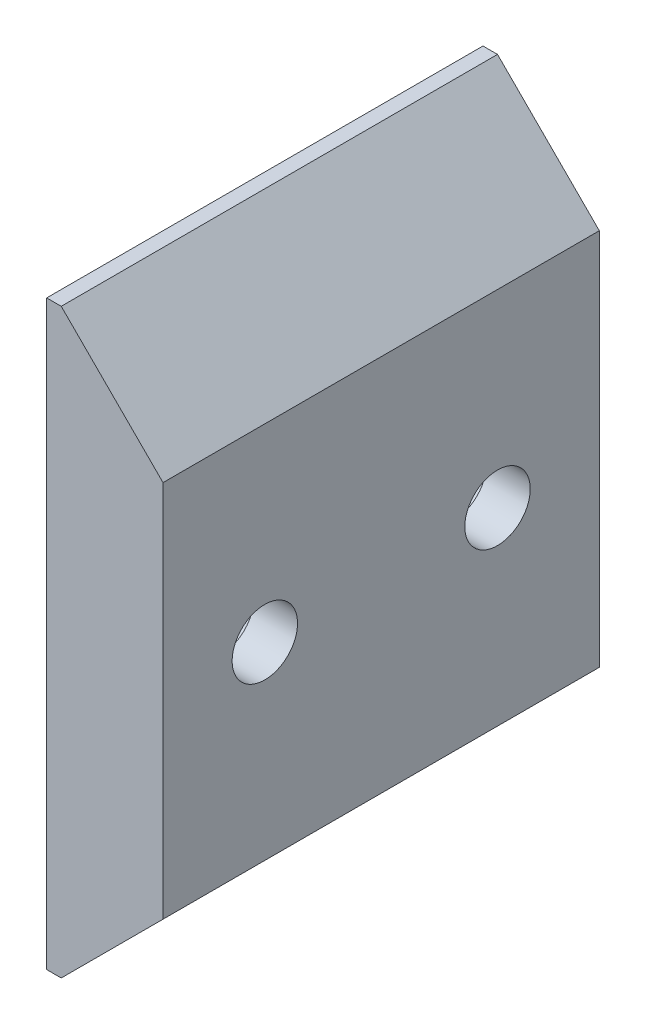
SolidWorks part; units mm, degrees
ref_plane "Face" through (0, 0, 0) normal (0, 0, 1) x (1, 0, 0)
ref_plane "Dessus" through (0, 0, 0) normal (0, 1, 0) x (1, 0, 0)
ref_plane "Droite" through (0, 0, 0) normal (1, 0, 0) x (0, 0, -1)
sketch "Esquisse1" plane through (0, 0, 0) normal (0, 0, 1) x (1, 0, 0)
  line L0 (0, -20) -> (0, 20)
  line L1 (0, 20) -> (1, 20)
  line L2 (1, 20) -> (8, 13)
  line L3 (8, 13) -> (8, -13)
  line L4 (0, 0) -> (21.8355, 0) construction
  line L5 (1, -20) -> (8, -13)
  line L6 (0, -20) -> (1, -20)
  point P8 (8, 0)
  dimension "D1" = 20
  dimension "D2" = 1
  dimension "D3" = 45
  dimension "D4" = 8
extrude "Extrusion1" add sketch "Esquisse1" along normal mid plane 30
hole_wizard "Chambrage pour vis à tête cylindrique à 6 pans creux (vis CHC) M41" positions "Esquisse3" profile "Esquisse2" counterbore size "M4" standard "ISO"
sketch "Esquisse3" plane through (0, 0, 0) normal (-1, 0, 0) x (0, 0, 1)
  line L0 (18.0597, 0) -> (-19.4338, 0) construction
  point P0 (8, 0)
  point P1 (-8, 0)
  dimension "D1" = 16
  dimension "D2" = 8
sketch "Esquisse2" plane through (0, 0, 8) normal (0, 1, 0) x (0, 0, 1)
  line L0 (0, 0) -> (0, 8)
  line L1 (0, 8) -> (2.25, 8)
  line L3 (2.25, 8) -> (2.25, 5)
  line L4 (2.25, 5) -> (4, 5)
  line L5 (4, 5) -> (4, 0)
  line L7 (4, 0) -> (0, 0)
  line L11 (0, -6.35) -> (0, 107.95) construction
  dimension "Diamètre du perçage jusqu'au prochain" = 4.5
  dimension "Profondeur du perçage jusqu'au prochain" = 8
  dimension "Diamètre du chambrage" = 8
  dimension "Profondeur du chambrage" = 5
